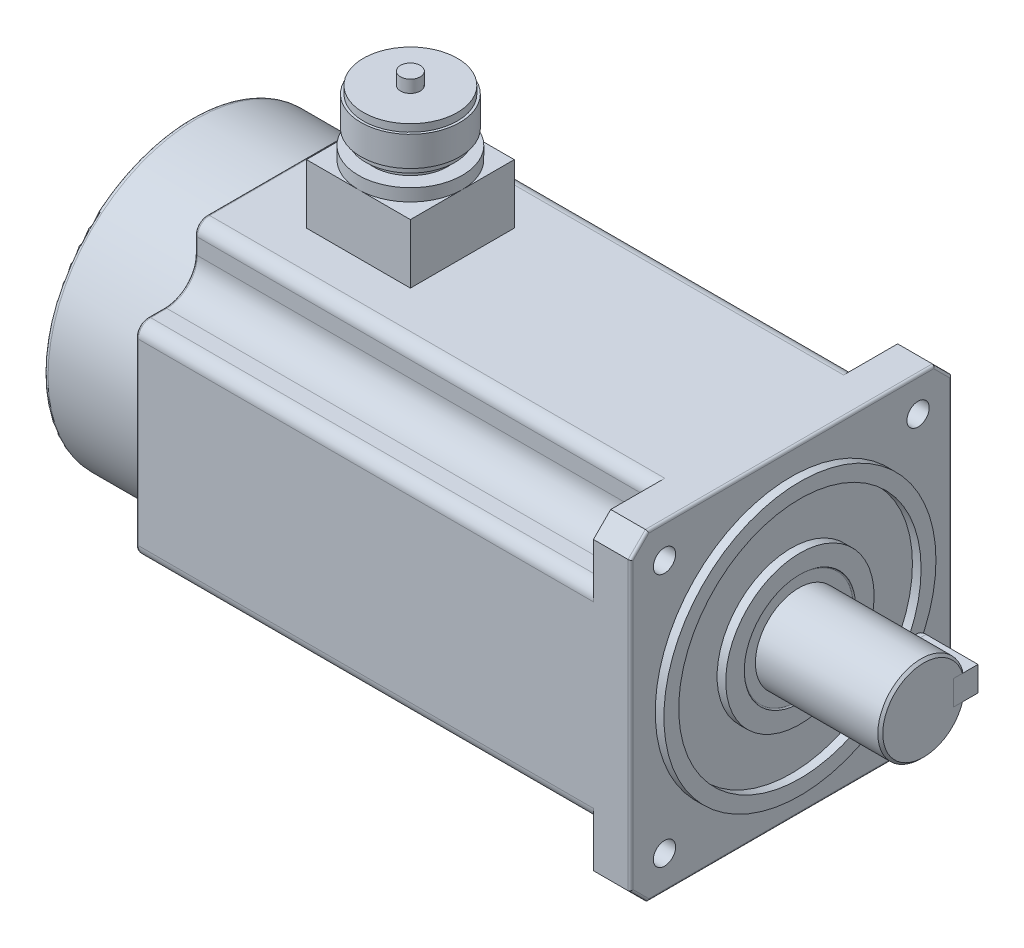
SolidWorks part; units mm, degrees
ref_plane "前视基准面" through (0, 0, 0) normal (0, 0, 1) x (1, 0, 0)
ref_plane "上视基准面" through (0, 0, 0) normal (0, 1, 0) x (1, 0, 0)
ref_plane "右视基准面" through (0, 0, 0) normal (1, 0, 0) x (0, 0, -1)
sketch "草图1" plane through (0, 0, 0) normal (1, 0, 0) x (0, 0, -1)
  line L0 (-65, 58) -> (-58, 65)
  line L1 (-58, -65) -> (58, -65)
  line L2 (-65, -58) -> (-65, 58)
  line L3 (-58, 65) -> (58, 65)
  line L4 (65, -58) -> (65, 58)
  line L5 (-65, -65) -> (65, 65) construction
  line L6 (-65, 65) -> (65, -65) construction
  line L7 (-58, -65) -> (-65, -58)
  line L8 (58, -65) -> (65, -58)
  line L9 (65, 58) -> (58, 65)
  point P0 (0, 0)
extrude "凸台-拉伸1" add sketch "草图1" against normal blind 200
sketch "草图2" plane through (-200, 0, 0) normal (-1, 0, 0) x (0, 0, 1)
  line L0 (-53.5, 41.1509) -> (-60, 41.1509)
  line L1 (-36.1509, 65) -> (-58, 65)
  line L2 (-41.1509, 53.5) -> (-41.1509, 60)
  line L3 (-58, 65) -> (58, 65) construction
  line L4 (-58, 65) -> (-65, 58)
  line L5 (41.1509, 60) -> (41.1509, 53.5)
  line L6 (-65, 58) -> (-58, 65) construction
  line L7 (-65, -58) -> (-65, 58) construction
  line L8 (53.5, 41.1509) -> (60, 41.1509)
  line L9 (-60, -41.1509) -> (-53.5, -41.1509)
  line L10 (-41.1509, -53.5) -> (-41.1509, -60)
  line L11 (58, -65) -> (-58, -65) construction
  line L12 (65, 58) -> (65, -58) construction
  line L13 (-65, 58) -> (-65, 36.1509)
  line L14 (60, -41.1509) -> (53.5, -41.1509)
  line L15 (-65, -36.1509) -> (-65, -58)
  line L16 (41.1509, -53.5) -> (41.1509, -60)
  line L17 (-65, -58) -> (-58, -65)
  line L18 (-58, -65) -> (-36.1509, -65)
  line L19 (36.1509, -65) -> (58, -65)
  line L20 (58, -65) -> (65, -58)
  line L21 (65, -58) -> (65, -36.1509)
  line L22 (65, 36.1509) -> (65, 58)
  line L23 (65, 58) -> (58, 65)
  line L24 (58, 65) -> (36.1509, 65)
  arc A0 (-53.5, 41.1509) -> (-41.1509, 53.5) centre (-53.5, 53.5) ccw
  arc A1 (41.1509, 53.5) -> (53.5, 41.1509) centre (53.5, 53.5) ccw
  arc A2 (53.5, -41.1509) -> (41.1509, -53.5) centre (53.5, -53.5) ccw
  arc A3 (-41.1509, -53.5) -> (-53.5, -41.1509) centre (-53.5, -53.5) ccw
  arc A4 (-41.1509, 60) -> (-36.1509, 65) centre (-36.1509, 60) cw
  arc A5 (36.1509, 65) -> (41.1509, 60) centre (36.1509, 60) cw
  arc A6 (60, 41.1509) -> (65, 36.1509) centre (60, 36.1509) cw
  arc A7 (65, -36.1509) -> (60, -41.1509) centre (60, -36.1509) cw
  arc A8 (36.1509, -65) -> (41.1509, -60) centre (36.1509, -60) ccw
  arc A9 (-36.1509, -65) -> (-41.1509, -60) centre (-36.1509, -60) cw
  arc A10 (-60, -41.1509) -> (-65, -36.1509) centre (-60, -36.1509) cw
  arc A11 (-65, 36.1509) -> (-60, 41.1509) centre (-60, 36.1509) cw
  point P0 (0, 0)
  point P10 (-41.1509, 65)
  point P39 (41.1509, 65)
  point P42 (65, 41.1509)
  point P45 (65, -41.1509)
  point P48 (41.1509, -65)
  point P51 (-41.1509, -65)
  point P54 (-65, -41.1509)
  point P57 (-65, 41.1509)
  dimension "D1" = 5
extrude "切除-拉伸1" cut sketch "草图2" against normal blind 185
fillet "圆角1" radius 1 8 edges at (0, 61.5, -61.5) (0, 0, -65) (0, -61.5, -61.5) (0, -65, 0) (0, -61.5, 61.5) (0, 0, 65) (0, 61.5, 61.5) (0, 65, 0)
fillet "圆角2" radius 1 24 edges at (-200, -44.7679, 44.7679) (-200, -56.75, 41.1509) (-200, -63.5355, 39.6864) (-200, -65, 0) (-200, -63.5355, -39.6864) (-200, -56.75, -41.1509) (-200, -44.7679, -44.7679) (-200, -41.1509, -56.75) (-200, -39.6864, -63.5355) (-200, 0, -65) (-200, 39.6864, -63.5355) (-200, 41.1509, -56.75) (-200, 44.7679, -44.7679) (-200, 56.75, -41.1509) (-200, 63.5355, -39.6864) (-200, 65, 0) (-200, 63.5355, 39.6864) (-200, 56.75, 41.1509) (-200, 44.7679, 44.7679) (-200, 41.1509, 56.75) (-200, 39.6864, 63.5355) (-200, 0, 65) (-200, -39.6864, 63.5355) (-200, -41.1509, 56.75)
sketch "草图3" plane through (-200, 0, 0) normal (-1, 0, 0) x (0, 0, 1)
  circle A0 centre (0, 0) radius 60
extrude "凸台-拉伸2" add sketch "草图3" along normal blind 42.5
fillet "圆角3" radius 2 1 edges at (-242.5, 0, 60)
sketch "草图4" plane through (0, 0, 0) normal (1, 0, 0) x (0, 0, -1)
  circle A0 centre (-51.2652, 51.2652) radius 4.5
  circle A1 centre (51.2652, 51.2652) radius 4.5
  circle A2 centre (51.2652, -51.2652) radius 4.5
  circle A3 centre (-51.2652, -51.2652) radius 4.5
  point P11 (-51.2652, 51.2652)
  point P12 (51.2652, 51.2652)
  point P13 (51.2652, -51.2652)
  point P14 (-51.2652, -51.2652)
extrude "切除-拉伸2" cut sketch "草图4" against normal blind 15
sketch "草图5" plane through (0, 0, 0) normal (1, 0, 0) x (0, 0, -1)
  circle A0 centre (0, 0) radius 55
  circle A1 centre (0, 0) radius 49
extrude "凸台-拉伸3" add sketch "草图5" along normal blind 3.5 separate body
sketch "草图6" plane through (0, 0, 0) normal (1, 0, 0) x (0, 0, -1)
  circle A0 centre (0, 0) radius 30
extrude "凸台-拉伸4" add sketch "草图6" along normal blind 3.5
sketch "草图7" plane through (3.5, 0, 0) normal (1, 0, 0) x (0, 0, -1)
  circle A0 centre (0, 0) radius 22.5
extrude "切除-拉伸3" cut sketch "草图7" against normal blind 0.5
sketch "草图8" plane through (3, 0, 0) normal (1, 0, 0) x (0, 0, -1)
  circle A0 centre (0, 0) radius 17.5
extrude "凸台-拉伸5" add sketch "草图8" along normal blind 50.5
fillet "圆角4" radius 0.5 1 edges at (3, 0, -22.5)
ref_plane "基准面1" through (0, 0, -17.5) normal (0, 0, 1) x (1, 0, 0)
sketch "草图9" plane through (0, 0, -17.5) normal (0, 0, 1) x (1, 0, 0)
  line L1 (53.5, -17.5) -> (53.5, 17.5) construction
  line L2 (32.5, 5) -> (53.5, 5)
  line L3 (53.5, 5) -> (53.5, -5)
  line L4 (53.5, -5) -> (32.5, -5)
  arc A0 (32.5, 5) -> (32.5, -5) centre (32.5, 0) ccw
extrude "切除-拉伸5" cut sketch "草图9" along normal blind 5.5
sketch "草图10" plane through (0, 0, -12) normal (0, 0, -1) x (-1, 0, 0)
  line L0 (-32.5, 5) -> (-53.5, 5)
  line L1 (-53.5, 5) -> (-53.5, -5)
  line L2 (-53.5, -5) -> (-32.5, -5)
  arc A0 (-32.5, -5) -> (-32.5, 5) centre (-32.5, 0) ccw
extrude "凸台-拉伸6" add sketch "草图10" along normal blind 10 separate body
chamfer "倒角1" distance 1 angle 45 1 edges at (53.5, 0, 17.5)
sketch "草图20" plane through (0, 65, 0) normal (0, 1, 0) x (1, 0, 0)
  line L3 (-175, -21) -> (-133, -21)
  line L4 (-175, -21) -> (-175, 21)
  line L5 (-175, 21) -> (-133, 21)
  line L6 (-133, -21) -> (-133, 21)
  line L7 (-175, -21) -> (-133, 21) construction
  line L8 (-175, 21) -> (-133, -21) construction
extrude "凸台-拉伸14" add sketch "草图20" along normal blind 24
sketch "草图21" plane through (0, 89, 0) normal (0, 1, 0) x (1, 0, 0)
  circle A0 centre (-154, 0) radius 21
extrude "凸台-拉伸15" add sketch "草图21" along normal blind 5
sketch "草图22" plane through (0, 94, 0) normal (0, 1, 0) x (1, 0, 0)
  circle A0 centre (-154, 0) radius 15
extrude "凸台-拉伸16" add sketch "草图22" along normal blind 3
sketch "草图23" plane through (0, 97, 0) normal (0, 1, 0) x (1, 0, 0)
  circle A0 centre (-154, 0) radius 18
extrude "凸台-拉伸17" add sketch "草图23" along normal blind 3
sketch "草图24" plane through (0, 100, 0) normal (0, 1, 0) x (1, 0, 0)
  circle A0 centre (-154, 0) radius 20
extrude "凸台-拉伸18" add sketch "草图24" along normal blind 12
sketch "草图25" plane through (0, 112, 0) normal (0, 1, 0) x (1, 0, 0)
  circle A0 centre (-154, 0) radius 19
extrude "凸台-拉伸19" add sketch "草图25" along normal blind 3
sketch "草图26" plane through (0, 115, 0) normal (0, 1, 0) x (1, 0, 0)
  circle A0 centre (-154, 0) radius 4
extrude "凸台-拉伸20" add sketch "草图26" along normal blind 5
